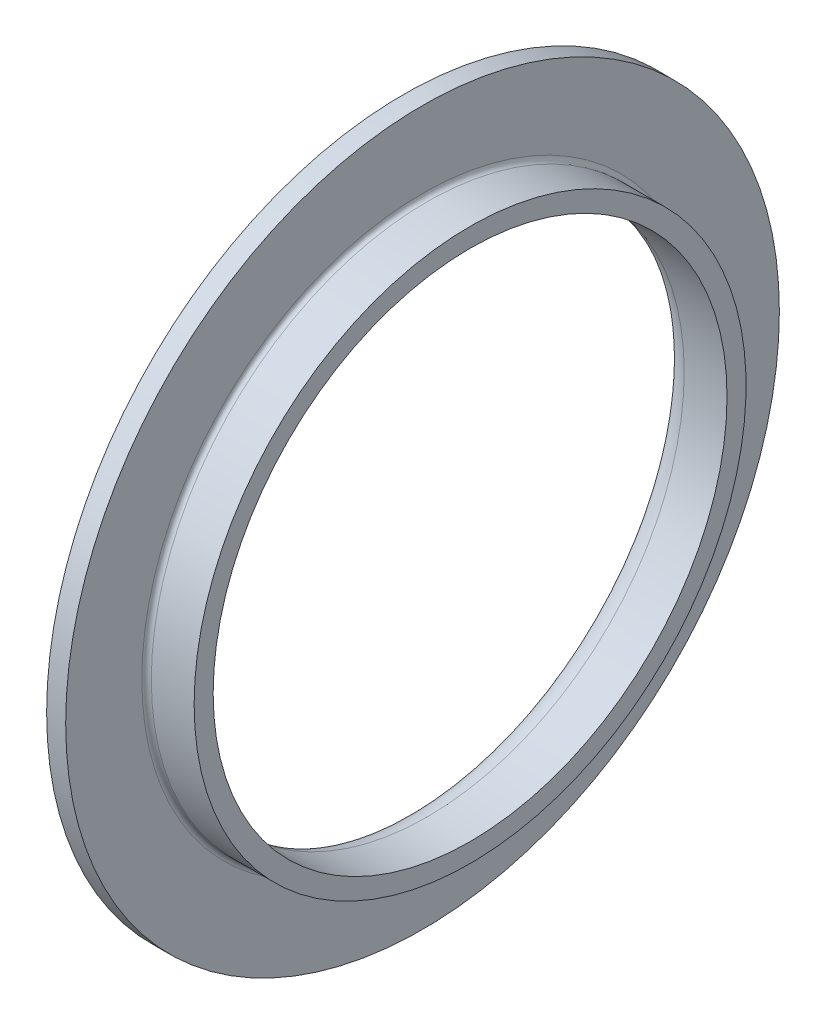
SolidWorks part; units mm, degrees
ref_plane "Plan1" through (0, 0, 0) normal (0, 0, 1) x (1, 0, 0)
ref_plane "Plan2" through (0, 0, 0) normal (0, 1, 0) x (1, 0, 0)
ref_plane "Plan3" through (0, 0, 0) normal (1, 0, 0) x (0, 0, -1)
sketch "Esquisse1" plane through (0, 0, 0) normal (0, 0, 1) x (1, 0, 0)
  line L0 (0, 0) -> (60, 0) construction
  line L1 (0, 37.5) -> (0, 29.5)
  line L2 (2.5, 27) -> (7, 27)
  arc A0 (2.5, 27) -> (0, 29.5) centre (2.5, 29.5) cw
  point P8 (0, 27)
  dimension "D4" = 2.5
  dimension "D1" = 27
  dimension "D2" = 7
  dimension "D3" = 37.5
revolve "Base-Révol.-Mince" add sketch "Esquisse1" angle 360 about L0
